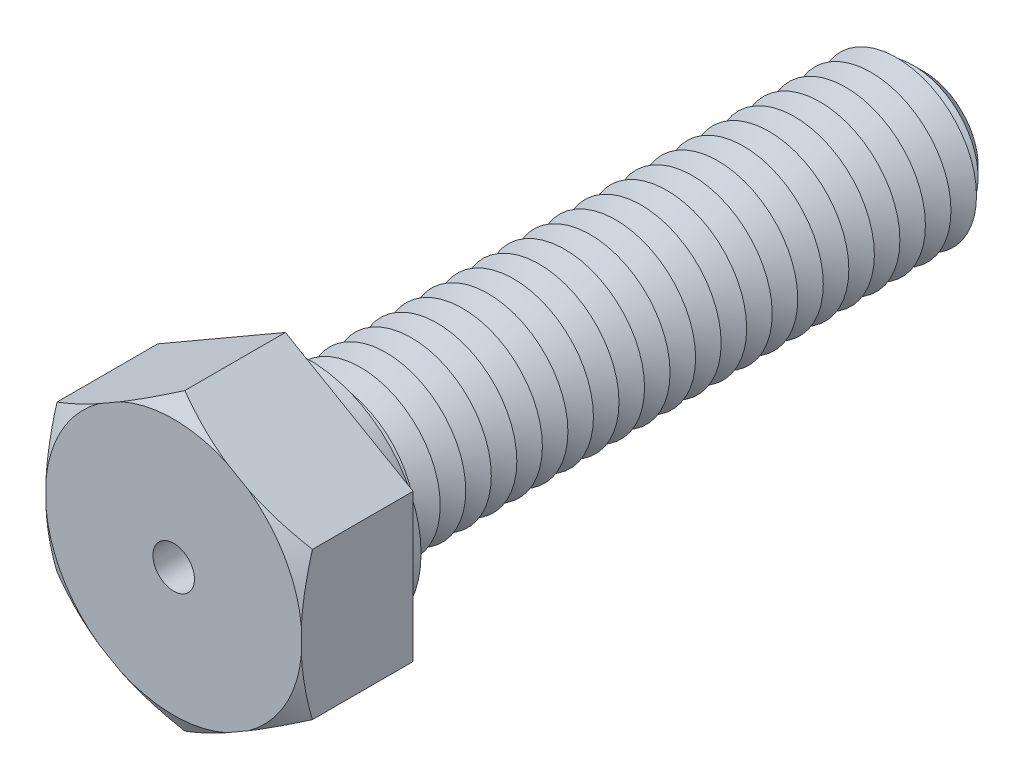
SolidWorks part; units mm, degrees
ref_plane "Front Plane" through (0, 0, 0) normal (0, 0, 1) x (1, 0, 0)
ref_plane "Top Plane" through (0, 0, 0) normal (0, 1, 0) x (1, 0, 0)
ref_plane "Right Plane" through (0, 0, 0) normal (1, 0, 0) x (0, 0, -1)
sketch "Sketch2" plane through (0, 0, 0) normal (0, 0, 1) x (1, 0, 0)
  line L1 (0, 4.6188) -> (-4, 2.3094)
  line L2 (-4, 2.3094) -> (-4, -2.3094)
  line L3 (-4, -2.3094) -> (0, -4.6188)
  line L4 (0, -4.6188) -> (4, -2.3094)
  line L5 (4, -2.3094) -> (4, 2.3094)
  line L6 (4, 2.3094) -> (0, 4.6188)
  circle A0 centre (0, 0) radius 4 construction
  dimension "D1" = 8
extrude "Boss-Extrude1" add sketch "Sketch2" along normal blind 3.5
sketch "Sketch3" plane through (0, 0, 0) normal (0, 0, -1) x (-1, 0, 0)
  circle A0 centre (0, 0) radius 2.5
  dimension "D1" = 5
extrude "Boss-Extrude2" add sketch "Sketch3" along normal blind 20
sketch "Sketch4" plane through (0, 0, 0) normal (0, 0, -1) x (-1, 0, 0)
  circle A0 centre (0, 0) radius 3.5
  dimension "D1" = 7
extrude "Boss-Extrude3" add sketch "Sketch4" along normal blind 0.75
sketch "Sketch5" plane through (0, 0, 0) normal (1, 0, 0) x (0, 0, -1)
  line L0 (-3.2117, 0) -> (6.3192, 0) construction
chamfer "Chamfer1" distance 0.8 angle 45 1 edges at (-2.5, 0, -20)
sketch "Sketch6" plane through (0, 0, 0) normal (1, 0, 0) x (0, 0, -1)
  line L0 (0.75, 2.5) -> (1.15, 1.8072)
  line L1 (1.15, 1.8072) -> (1.55, 2.5)
  line L2 (19.2, 2.5) -> (0.75, 2.5) construction
  line L3 (1.55, 2.5) -> (0.75, 2.5)
  dimension "D1" = 0.8
revolve "Cut-Revolve1" cut sketch "Sketch6" angle 360 about L0
pattern_linear "LPattern1" count 24 spacing 0.8 along (0, 0, -1) of "Cut-Revolve1"
sketch "Sketch7" plane through (0, 0, 0) normal (1, 0, 0) x (0, 0, -1)
  line L0 (-3.5, 4.6188) -> (-3.5, 4.0188)
  line L1 (-3.5, 2.3094) -> (-3.5, 4.6188) construction
  line L2 (-3.5, 4.0188) -> (-3.1536, 4.6188)
  line L3 (-3.5, 4.6188) -> (0, 4.6188) construction
  line L4 (-3.1536, 4.6188) -> (-3.5, 4.6188)
  dimension "D1" = 0.6
  dimension "D2" = 30
revolve "Cut-Revolve2" cut sketch "Sketch7" angle 360 about L0
sketch "Sketch8" plane through (0, 0, 3.5) normal (0, 0, 1) x (1, 0, 0)
  circle A0 centre (0, 0) radius 0.65
  dimension "D1" = 1.3
extrude "Cut-Extrude1" cut sketch "Sketch8" against normal up to surface (23.5 mm away)
